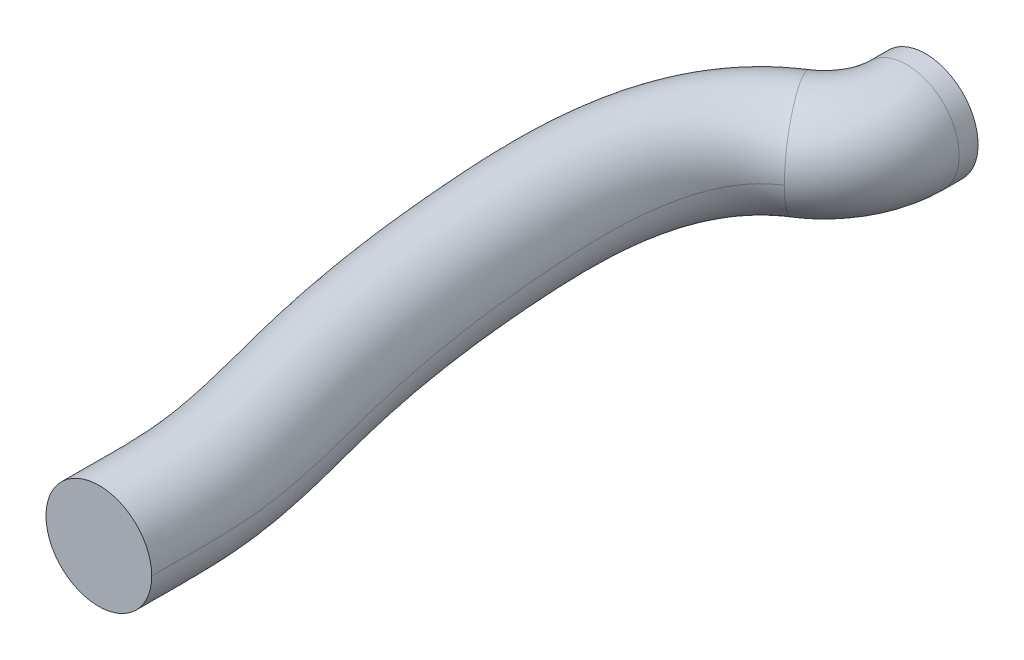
SolidWorks part; units mm, degrees
ref_plane "Front Plane" through (0, 0, 0) normal (0, 0, 1) x (1, 0, 0)
ref_plane "Top Plane" through (0, 0, 0) normal (0, 1, 0) x (1, 0, 0)
ref_plane "Right Plane" through (0, 0, 0) normal (1, 0, 0) x (0, 0, -1)
imported_body "Imported3"
sketch "Sketch1" plane through (0, 0, 1.08) normal (0, 0, -1) x (-1, 0, 0)
  circle A0 centre (0, 0) radius 3
extrude "Boss-Extrude1" add sketch "Sketch1" along normal blind 1.08
